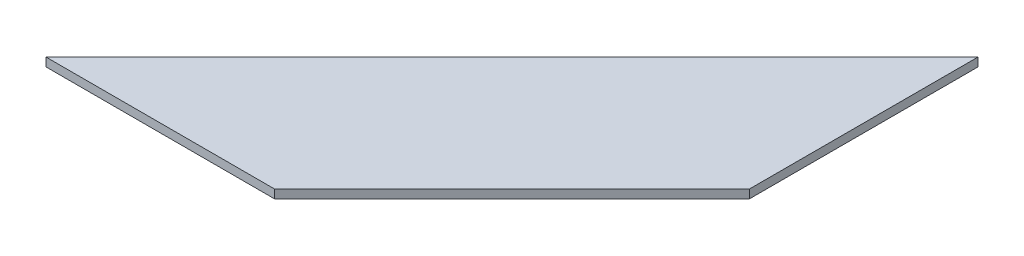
SolidWorks part; units mm, degrees
ref_plane "Plan de face" through (0, 0, 0) normal (0, 0, 1) x (1, 0, 0)
ref_plane "Plan de dessus" through (0, 0, 0) normal (0, 1, 0) x (1, 0, 0)
ref_plane "Plan de droite" through (0, 0, 0) normal (1, 0, 0) x (0, 0, -1)
ref_plane "Plan1" through (0, 1.5, 0) normal (0, 1, 0) x (1, 0, 0)
sketch "Esquisse1" plane through (0, 1.5, 0) normal (0, 1, 0) x (1, 0, 0)
  line L0 (-163, 0) -> (-83, 0)
  line L1 (-83, 0) -> (0, 83)
  line L2 (0, 83) -> (0, 163)
  line L3 (0, 163) -> (-163, 0)
extrude "Boss.-Extru.1" add sketch "Esquisse1" against normal blind 3
